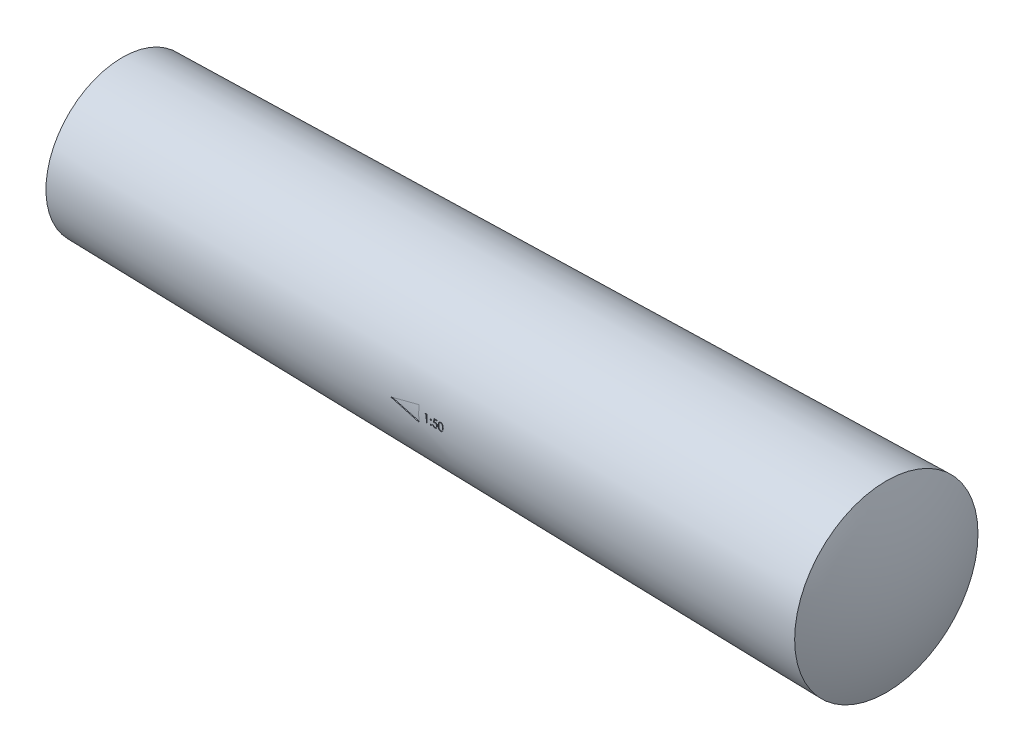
SolidWorks part; units mm, degrees
ref_plane "Front Plane" through (0, 0, 0) normal (0, 0, 1) x (1, 0, 0)
ref_plane "Top Plane" through (0, 0, 0) normal (0, 1, 0) x (1, 0, 0)
ref_plane "Right Plane" through (0, 0, 0) normal (1, 0, 0) x (0, 0, -1)
sketch "Sketch1" plane through (0, 0, 0) normal (1, 0, 0) x (0, 0, -1)
  circle A0 centre (0, 0) radius 10
  dimension "D1" = 20
extrude "Extrude1" add sketch "Sketch1" along normal mid plane 100
draft "Draft1" type of draft neutral plane draft angle 1.146 faces to draft 1 parameters "D1"=1.146
sketch "Sketch2" plane through (0, 0, 0) normal (0, 0, 1) x (1, 0, 0)
  line L0 (-50, 0) -> (-50, 10)
  line L1 (-50, 10) -> (-50, -10) construction
  line L2 (-50, 0) -> (-52.5, 0)
  line L3 (-52.5, 0) -> (-52.5, -11) construction
  line L4 (50, 0) -> (50, 12.0001)
  line L5 (50, -12.0001) -> (50, 12.0001) construction
  line L6 (50, 0) -> (52.5, 0)
  line L7 (52.5, 0) -> (52.5, -11) construction
  line L8 (-50, -10) -> (50, -12.0001) construction
  arc A0 (-52.5, 0) -> (-50, 10) centre (-31.25, 0) cw
  arc A1 (52.5, 0) -> (50, 12.0001) centre (22.4497, 0) ccw
  point P14 (0, -11)
revolve "Revolve1" add sketch "Sketch2" angle 360 about L2
sketch "Sketch5" plane through (0, 0, 0) normal (0, 0, 1) x (1, 0, 0)
  line L0 (0, 11) -> (0, -11) construction
  line L1 (50, 12.0001) -> (-50, 10) construction
  line L2 (-50, -10) -> (50, -12.0001) construction
ref_plane "Plane2" through (0, 0, 0) normal (-0.02, 0, 0.9998) x (0.9998, 0, 0.02)
sketch "Sketch6" plane through (0, 0, 0) normal (-0.02, 0, 0.9998) x (0.9998, 0, 0.02)
  line L0 (0, 0) -> (0, 1)
  line L1 (0, 11) -> (0, -11) construction
  line L2 (0, 1) -> (-3.7321, 0)
  line L3 (-3.7321, 0) -> (0, -1)
  line L4 (0, -1) -> (0, 0)
  line L5 (0, -0.5) -> (4, -0.5) construction
  text T0 "1:50" font "Century Gothic" height 1
  dimension "D1" = 2
  dimension "D2" = 30
  dimension "D3" = 4
wrap "Wrap2" sketch "Sketch6" wrap type deboss source sketch "Sketch6" thickness 0.1 parameters "D1"=0.1
equation "\"D2@Sketch2\" = \"D1@Sketch2\""
